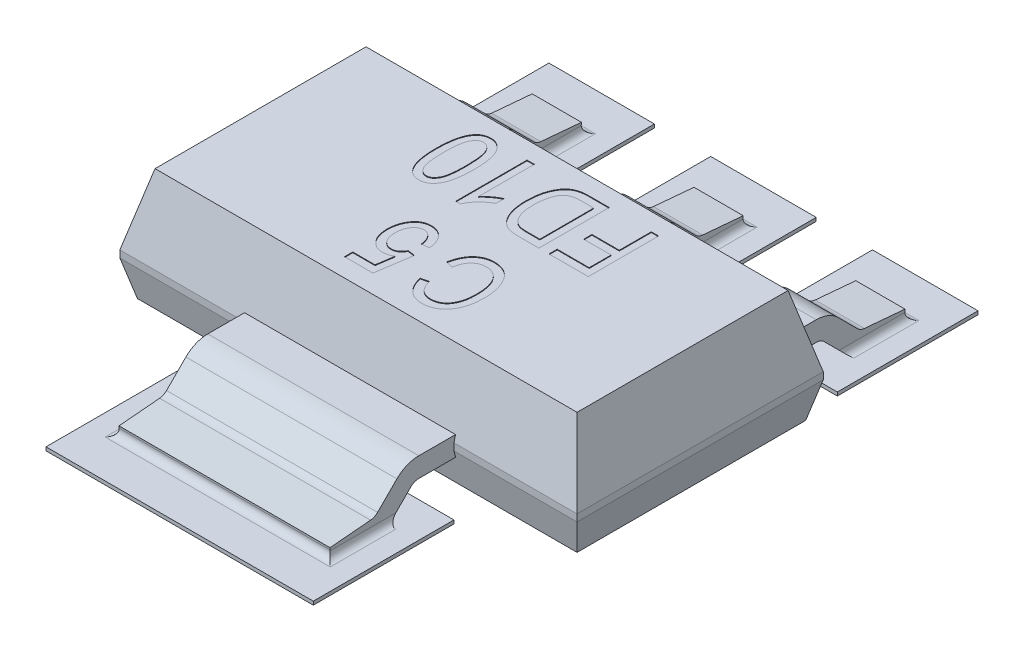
SolidWorks part; units mm, degrees
ref_plane "Front Plane" through (0, 0, 0) normal (0, 0, 1) x (1, 0, 0)
ref_plane "Top Plane" through (0, 0, 0) normal (0, 1, 0) x (1, 0, 0)
ref_plane "Right Plane" through (0, 0, 0) normal (1, 0, 0) x (0, 0, -1)
sketch "Sketch1" plane through (0, 0, 0) normal (0, 1, 0) x (1, 0, 0)
  line L0 (0, -55) -> (0, 55) construction
  line L1 (-3.25, 1.75) -> (3.25, 1.75)
  line L2 (-3.25, 1.75) -> (-3.25, -1.75)
  line L3 (-3.25, -1.75) -> (3.25, -1.75)
  line L4 (3.25, 1.75) -> (3.25, -1.75)
  line L5 (-55, 0) -> (55, 0) construction
  dimension "D1" = 6.5
  dimension "D2" = 3.25
  dimension "D3" = 3.5
  dimension "D4" = 1.75
extrude "Boss-Extrude1" add sketch "Sketch1" along normal blind 1.6
chamfer "Chamfer1" distance 1 distance2 0.25 4 edges at (-3.25, 1.6, 0) (0, 1.6, -1.75) (3.25, 1.6, 0) (0, 1.6, 1.75)
chamfer "Chamfer2" distance 0.125 distance2 0.5 4 edges at (0, 0, 1.75) (-3.25, 0, 0) (0, 0, -1.75) (3.25, 0, 0)
sketch "Sketch2" plane through (0, 0, 0) normal (1, 0, 0) x (0, 0, -1)
  line L0 (0, 0.55) -> (-2.25, 0.55)
  line L1 (0, 0.88) -> (0, -0.88) construction
  line L2 (-2.4621, 0.4621) -> (-2.7371, 0.1872)
  line L3 (-2.923, 0.1005) -> (-3.5, 0.05)
  line L4 (1.925, 0) -> (-1.925, 0) construction
  arc A0 (-2.25, 0.55) -> (-2.4621, 0.4621) centre (-2.25, 0.25) ccw
  arc A1 (-2.7371, 0.1872) -> (-2.923, 0.1005) centre (-2.9492, 0.3993) cw
  dimension "D4" = 0.3
  dimension "D1" = 0.55
  dimension "D2" = 3.5
  dimension "D3" = 0.05
  dimension "D5" = 45
  dimension "D6" = 5
  dimension "D7" = 2.25
extrude "Extrude-Thin1" add sketch "Sketch2" along normal mid plane 3 thin
ref_plane "Plane1" through (2.3, 0, 0) normal (1, 0, 0) x (0, 0, -1)
sketch "Sketch3" plane through (2.3, 0, 0) normal (1, 0, 0) x (0, 0, -1)
  line L0 (0, 0.55) -> (2.25, 0.55)
  line L1 (0, 0.88) -> (0, -0.88) construction
  line L2 (2.4621, 0.4621) -> (2.7371, 0.1872)
  line L3 (2.923, 0.1005) -> (3.5, 0.05)
  line L4 (0, 0.55) -> (-2.25, 0.55) construction
  arc A0 (2.7371, 0.1872) -> (2.923, 0.1005) centre (2.9492, 0.3993) ccw
  arc A1 (2.25, 0.55) -> (2.4621, 0.4621) centre (2.25, 0.25) cw
  dimension "D2" = 0.3
  dimension "D1" = 3.5
  dimension "D3" = 2.25
  dimension "D4" = 45
extrude "Extrude-Thin2" add sketch "Sketch3" along normal mid plane 0.7 thin
pattern_linear "LPattern1" count 3 spacing 2.3 along (-1, 0, 0) of "Extrude-Thin2"
sketch "Sketch4" plane through (0, 0, 0) normal (0, 1, 0) x (1, 0, 0)
  line L0 (-1.9, -3.15) -> (1.9, -3.15) construction
  line L1 (-1.9, -2.15) -> (1.9, -2.15)
  line L2 (-1.9, -2.15) -> (-1.9, -4.15)
  line L3 (-1.9, -4.15) -> (1.9, -4.15)
  line L4 (1.9, -2.15) -> (1.9, -4.15)
  line L5 (-0.88, 0) -> (0.88, 0) construction
  line L6 (0, -0.9292) -> (0, 0.9292) construction
  line L7 (-3.05, 3.15) -> (-1.55, 3.15) construction
  line L8 (-3.05, 4.15) -> (-1.55, 4.15)
  line L9 (-3.05, 4.15) -> (-3.05, 2.15)
  line L10 (-3.05, 2.15) -> (-1.55, 2.15)
  line L11 (-1.55, 4.15) -> (-1.55, 2.15)
  line L12 (0.75, 4.15) -> (-0.75, 4.15)
  line L13 (0.75, 4.15) -> (0.75, 2.15)
  line L14 (0.75, 2.15) -> (-0.75, 2.15)
  line L15 (-0.75, 4.15) -> (-0.75, 2.15)
  line L16 (1.55, 4.15) -> (3.05, 4.15)
  line L17 (1.55, 4.15) -> (1.55, 2.15)
  line L18 (1.55, 2.15) -> (3.05, 2.15)
  line L19 (3.05, 4.15) -> (3.05, 2.15)
  dimension "D1" = 3.15
  dimension "D2" = 1
  dimension "D3" = 3.8
  dimension "D4" = 1.9
  dimension "D5" = 1.5
  dimension "D6" = 2.3
  dimension "D7" = 2.3
  dimension "D8" = 3.15
  dimension "D9" = 0.75
  dimension "D10" = 2
extrude "Boss-Extrude2" add sketch "Sketch4" along normal blind 0.05
fillet "Fillet1" radius 0.1 12 edges at (-1.5, 0.05, 3.0908) (0, 0.05, 3.5) (1.5, 0.05, 3.0908) (2.65, 0.05, -3.0908) (2.3, 0.05, -3.5) (1.95, 0.05, -3.0908) (-0.35, 0.05, -3.0908) (0.35, 0.05, -3.0908) (0, 0.05, -3.5) (-1.95, 0.05, -3.0908) (-2.3, 0.05, -3.5) (-2.65, 0.05, -3.0908)
sketch "Sketch5" plane through (0, 1.6, 0) normal (0, 1, 0) x (1, 0, 0)
  line L0 (1, -0.25) -> (-2.199, -0.25) construction
  line L1 (0, -0.9292) -> (0, 0.9292) construction
  line L2 (-0.88, 0) -> (0.88, 0) construction
  text T0 "C5" font "Arial Narrow" height 1
  dimension "D1" = 1
  dimension "D2" = 0.25
sketch "Sketch6" plane through (0, 1.6, 0) normal (0, 1, 0) x (1, 0, 0)
  line L0 (1.5, 1.25) -> (-2.6137, 1.25) construction
  line L1 (-0.88, 0) -> (0.88, 0) construction
  line L2 (0, -0.9292) -> (0, 0.9292) construction
  text T0 "FD10" font "Arial Narrow" height 1
  dimension "D1" = 1.25
  dimension "D2" = 1.5
extrude "Cut-Extrude1" cut sketch "Sketch5" against normal blind 0.01
extrude "Cut-Extrude2" cut sketch "Sketch6" against normal blind 0.01
